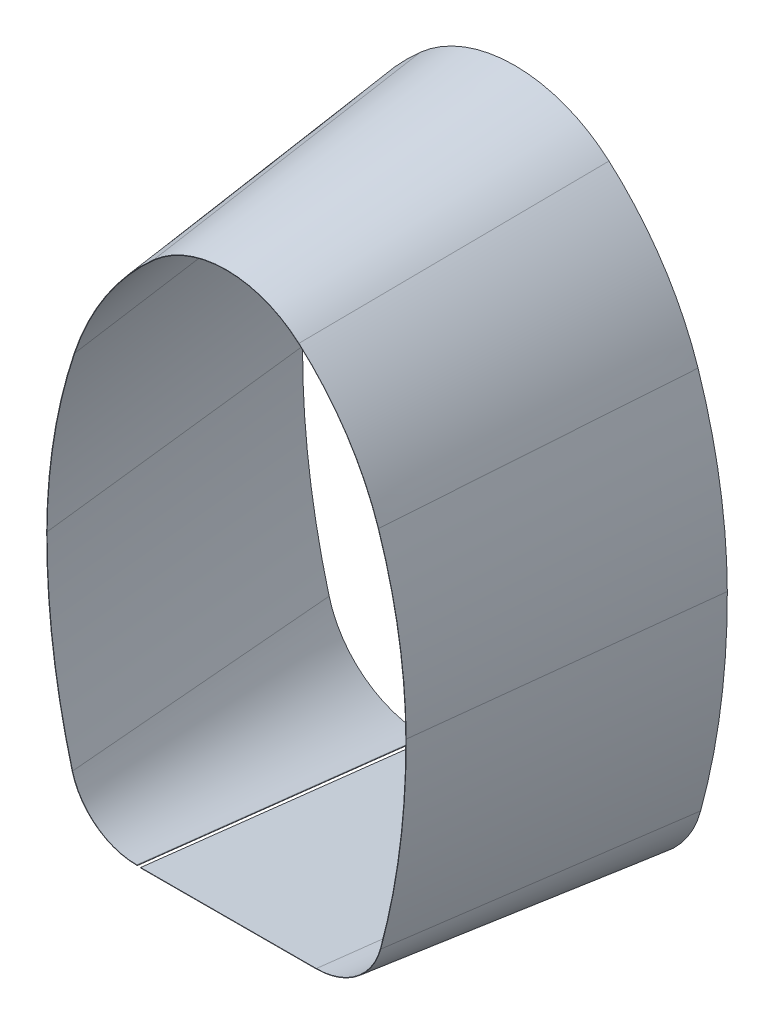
SolidWorks part; units mm, degrees
ref_plane "Vorne" through (0, 0, 0) normal (0, 0, 1) x (1, 0, 0)
ref_plane "Oben" through (0, 0, 0) normal (0, 1, 0) x (1, 0, 0)
ref_plane "Rechts" through (0, 0, 0) normal (1, 0, 0) x (0, 0, -1)
imported_body "Importiert1"
sketch "Skizze3" plane through (0, 0, 2.9703) normal (0, 0, 1) x (1, 0, 0)
  line L0 (32.7933, -32.2843) -> (32.9864, -32.3365) construction
  line L1 (-13.7277, -37.2978) -> (-13.6277, -37.2978)
  line L2 (0, -37.2978) -> (0, 48.3279) construction
  line L5 (-13.1311, -37.3555) -> (13.7496, -37.2978)
  arc A0 (11.0521, 44.1425) -> (-11.0521, 44.1425) centre (0, 31.6431) ccw
  arc A1 (11.0521, 44.1425) -> (23.2144, 25.7293) centre (-17.0571, 12.3525) cw
  arc A2 (13.7496, -37.2978) -> (23.5416, -29.7846) centre (13.7277, -27.1317) ccw
  arc A3 (23.5416, -29.7846) -> (27.433, -0.0427) centre (-84.9013, -0.4704) ccw
  arc A4 (23.2144, 25.7293) -> (27.433, -0.0427) centre (-55.3216, -0.3576) cw
  arc A5 (-23.2144, 25.7293) -> (-27.433, -0.0427) centre (55.3216, -0.3576) ccw
  arc A6 (-23.5416, -29.7846) -> (-27.433, -0.0427) centre (84.9013, -0.4704) cw
  arc A7 (-13.7277, -37.2978) -> (-23.5416, -29.7846) centre (-13.7277, -27.1317) cw
  arc A8 (-11.0521, 44.1425) -> (-23.2144, 25.7293) centre (17.0571, 12.3525) ccw
  spline S0 degree 3 number of poles 146 (-11.0459, 44.1461) -> (27.433, -0.0427) construction
  spline S1 degree 3 poles (27.433, -0.0427) (27.429, 0.9617) (27.4115, 1.9661) (27.3729, 3.2211) (27.3643, 3.472) (27.3502, 3.8484) (27.3453, 3.9738) (27.3346, 4.2248) (27.329, 4.3503) (27.2992, 4.9778) (27.2702, 5.4799) (27.1, 7.9903) (26.8822, 9.9984) (25.9897, 15.9929) (25.0764, 19.9484) (23.551, 24.7591) (23.2267, 25.7145) (22.7118, 27.1361) (22.5354, 27.608) (22.3317, 28.1366) (22.309, 28.1953) (22.2634, 28.3126) (22.2405, 28.3712) (22.1712, 28.547) (22.1244, 28.664) (21.9824, 29.0147) (21.8854, 29.2478) (20.9913, 31.3399) (20.0484, 33.1557) (17.8923, 36.6305) (16.6769, 38.2877) (14.018, 41.3872) (12.5758, 42.8309) (11.048, 44.1461) knots 0 0 0 0 0.0625 0.0625 0.078125 0.078125 0.085938 0.085938 0.09375 0.09375 0.125 0.125 0.25 0.25 0.5 0.5 0.5625 0.5625 0.59375 0.59375 0.597656 0.597656 0.601562 0.601562 0.609375 0.609375 0.625 0.625 0.75 0.75 0.875 0.875 1 1 1 1 construction
  spline S4 degree 3 poles (11.048, 44.1461) (10.3582, 44.7559) (9.5945, 45.3265) (7.9378, 46.3496) (7.0446, 46.802) (5.1523, 47.5453) (4.1546, 47.8339) (2.1056, 48.2252) (1.0539, 48.3279) (-1.0521, 48.328) (-2.1035, 48.2252) (-4.1524, 47.8339) (-5.1503, 47.5453) (-7.0426, 46.802) (-7.9358, 46.3496) (-9.5924, 45.3266) (-10.3562, 44.7559) (-11.0459, 44.1461) knots 0 0 0 0 0.125 0.125 0.25 0.25 0.375 0.375 0.5 0.5 0.625 0.625 0.75 0.75 0.875 0.875 1 1 1 1 construction
  dimension "D1" = 0.1
  dimension "D2" = 0.5
sketch "Skizze37" plane through (0, 0, 0) normal (1, 0, 0) x (0, 0, -1)
  line L0 (40.9439, -42.3012) -> (-2.9703, -37.2978)
  line L1 (41.1241, -42.3217) -> (-2.9703, -37.2978)
  line L2 (41.1241, 53.5332) -> (41.1241, 62.3097)
  line L3 (41.1241, 53.5332) -> (41.1241, 62.3097) construction
  line L4 (41.1241, -48.4026) -> (41.1241, -42.5031)
  line L5 (41.1241, -48.4026) -> (41.1241, -42.5031) construction
ref_plane "Ebene2" through (0, 0, -41.1241) normal (0, 0, 1) x (1, 0, 0)
sketch "Skizze38" plane through (0, 0, -41.1241) normal (0, 0, 1) x (1, 0, 0)
  line L4 (-13.7277, -42.3217) -> (-13.6277, -42.3217)
  line L5 (-13.1203, -42.3794) -> (13.7604, -42.3217)
  line L6 (-13.7277, -42.3217) -> (-13.6277, -42.3217)
  line L7 (-13.1203, -42.3794) -> (13.7604, -42.3217)
  arc A18 (-28.3914, -31.0956) -> (-13.7277, -42.3217) centre (-13.7277, -27.1317) ccw
  arc A19 (-32.4569, -0.0236) -> (-28.3914, -31.0956) centre (84.9013, -0.4704) ccw
  arc A20 (-27.9821, 27.313) -> (-32.4569, -0.0236) centre (55.3216, -0.3576) ccw
  arc A21 (-14.38, 47.9061) -> (-27.9821, 27.313) centre (17.0571, 12.3525) ccw
  arc A22 (14.38, 47.9061) -> (-14.38, 47.9061) centre (0, 31.6431) ccw
  arc A23 (27.9821, 27.313) -> (14.38, 47.9061) centre (-17.0571, 12.3525) ccw
  arc A24 (32.4569, -0.0236) -> (27.9821, 27.313) centre (-55.3216, -0.3576) ccw
  arc A25 (28.3914, -31.0956) -> (32.4569, -0.0236) centre (-84.9013, -0.4704) ccw
  arc A26 (13.7604, -42.3217) -> (28.3914, -31.0956) centre (13.7277, -27.1317) ccw
  arc A27 (-28.3914, -31.0956) -> (-13.7277, -42.3217) centre (-13.7277, -27.1317) ccw
  arc A28 (-32.4569, -0.0236) -> (-28.3914, -31.0956) centre (84.9013, -0.4704) ccw
  arc A29 (-27.9821, 27.313) -> (-32.4569, -0.0236) centre (55.3216, -0.3576) ccw
  arc A30 (-14.38, 47.9061) -> (-27.9821, 27.313) centre (17.0571, 12.3525) ccw
  arc A31 (14.38, 47.9061) -> (-14.38, 47.9061) centre (0, 31.6431) ccw
  arc A32 (27.9821, 27.313) -> (14.38, 47.9061) centre (-17.0571, 12.3525) ccw
  arc A33 (32.4569, -0.0236) -> (27.9821, 27.313) centre (-55.3216, -0.3576) ccw
  arc A34 (28.3914, -31.0956) -> (32.4569, -0.0236) centre (-84.9013, -0.4704) ccw
  arc A35 (13.7604, -42.3217) -> (28.3914, -31.0956) centre (13.7277, -27.1317) ccw
  dimension "D1" = 5.0239
delete or keep bodies "Körper-Löschen2" type delete bodies bodies 102
sheet metal parameters "Blech14" thickness 0.057 parameters "D1"=1, "Dicke"=0.057
lofted bend "Ausgeformte Biegungen15" parameters "D1"=0, "D12"=0.057
other "Freiform-Biegung197" parameters "D1"=1000, "D4"=74.75, "D5"=1
other "Freiform-Biegung198" parameters "D1"=1000, "D4"=15.345, "D5"=2
other "Freiform-Biegung199" parameters "D1"=1000, "D4"=18.157, "D5"=3
other "Freiform-Biegung200" parameters "D1"=1000, "D4"=30.142, "D5"=4
other "Freiform-Biegung201" parameters "D1"=1000, "D4"=82.967, "D5"=5
other "Freiform-Biegung202" parameters "D1"=1000, "D4"=30.142, "D5"=6
other "Freiform-Biegung203" parameters "D1"=1000, "D4"=18.157, "D5"=7
other "Freiform-Biegung204" parameters "D1"=1000, "D4"=15.345, "D5"=8
other "Freiform-Biegung205" parameters "D1"=1000, "D4"=74.873, "D5"=9
flat pattern "Abwicklung13"
sketch "Biegung-Linien13" plane through (0, 0, 0) normal (0, 1, 0) x (-1, 0, 0)
other "Abwickeln-<Freiform-Biegung197>1"
other "Abwickeln-<Freiform-Biegung198>1"
other "Abwickeln-<Freiform-Biegung199>1"
other "Abwickeln-<Freiform-Biegung200>1"
other "Abwickeln-<Freiform-Biegung201>1"
other "Abwickeln-<Freiform-Biegung202>1"
other "Abwickeln-<Freiform-Biegung203>1"
other "Abwickeln-<Freiform-Biegung204>1"
other "Abwickeln-<Freiform-Biegung205>1"
